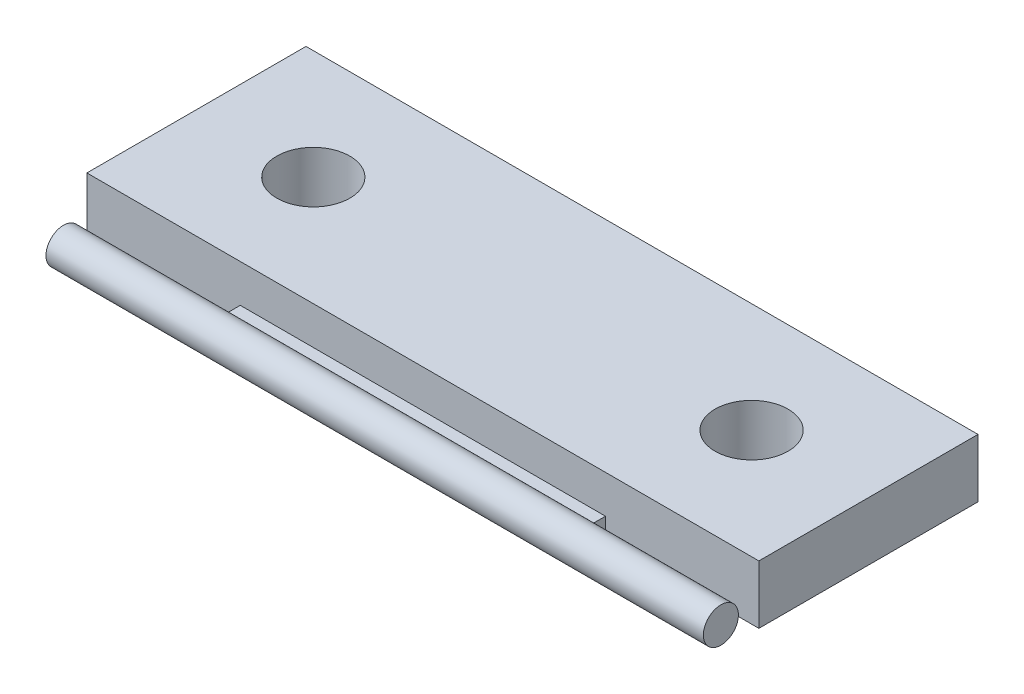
SolidWorks part; units mm, degrees
ref_plane "Front Plane" through (0, 0, 0) normal (0, 0, 1) x (1, 0, 0)
ref_plane "Top Plane" through (0, 0, 0) normal (0, 1, 0) x (1, 0, 0)
ref_plane "Right Plane" through (0, 0, 0) normal (1, 0, 0) x (0, 0, -1)
sketch "Sketch1" plane through (0, 0, 0) normal (0, 1, 0) x (1, 0, 0)
  line L1 (-25, 7.5) -> (25, 7.5)
  line L2 (-25, 7.5) -> (-25, -7.5)
  line L3 (-25, -7.5) -> (25, -7.5)
  line L4 (25, 7.5) -> (25, -7.5)
  line L5 (-25, 7.5) -> (25, -7.5) construction
  line L6 (-25, -7.5) -> (25, 7.5) construction
  point P0 (0, 0)
  dimension "D1" = 50
  dimension "D2" = 15
extrude "Boss-Extrude1" add sketch "Sketch1" along normal blind 2
sketch "Sketch2" plane through (25, 0, 0) normal (1, 0, 0) x (0, 0, -1)
  line L0 (-7.5, 2) -> (-7.5, 0) construction
  line L1 (-7.5, 1.4) -> (-7.5, 0.6)
  line L2 (-8.4686, 1.4) -> (-7.5, 1.4)
  line L3 (-8.4686, 0.6) -> (-7.5, 0.6)
  arc A1 (-8.4686, 1.4) -> (-8.4686, 0.6) centre (-9.6, 1) ccw
  dimension "D3" = 2.4
  dimension "D2" = 2.1
extrude "Boss-Extrude2" add sketch "Sketch2" against normal blind 25 from offset 12.5
sketch "Sketch3" plane through (12.5, 0, 0) normal (1, 0, 0) x (0, 0, -1)
  circle A0 centre (-9.6, 1) radius 1.2
extrude "Boss-Extrude3" add sketch "Sketch3" along normal blind 10 and the other way blind 35
sketch "Sketch5" plane through (0, 2, 0) normal (0, 1, 0) x (1, 0, 0)
  line L0 (-25, 7.5) -> (-25, -7.5) construction
  line L1 (25, -7.5) -> (25, 7.5) construction
  circle A0 centre (-15, 0) radius 2.5
  circle A1 centre (15, 0) radius 2.5
  dimension "D1" = 5
  dimension "D2" = 5
  dimension "D3" = 10
  dimension "D4" = 10
extrude "Cut-Extrude1" cut sketch "Sketch5" against normal blind 10
sketch "Sketch7" plane through (0, 2, 0) normal (0, 1, 0) x (1, 0, 0)
  line L4 (25, -7.5) -> (25, 7.5)
  line L5 (25, 7.5) -> (-25, 7.5)
  line L6 (-25, 7.5) -> (-25, -7.5)
  line L7 (-25, -7.5) -> (25, -7.5)
  line L8 (25, -7.5) -> (25, 7.5)
  line L9 (25, 7.5) -> (-25, 7.5)
  line L10 (-25, 7.5) -> (-25, -7.5)
  line L11 (-25, -7.5) -> (25, -7.5)
  circle A1 centre (15, 0) radius 2.5
  circle A2 centre (15, 0) radius 2.5
  circle A3 centre (-15, 0) radius 2.5
  circle A4 centre (-15, 0) radius 2.5
  dimension "D1" = 0
  dimension "D2" = 0
  dimension "D3" = 0
extrude "Boss-Extrude5" add sketch "Sketch7" along normal blind 2
sketch "Sketch8" plane through (0, 4, 0) normal (0, 1, 0) x (1, 0, 0)
  line L0 (-29.5253, 10.8151) -> (-23, 10.8151)
  line L1 (-23, 10.8151) -> (-23, -16.6248)
  line L2 (-23, -16.6248) -> (-29.5253, -16.6248)
  line L3 (-29.5253, -16.6248) -> (-29.5253, 10.8151)
  line L4 (23, 10.8151) -> (23, -16.6248)
  line L5 (23, -16.6248) -> (29.9436, -16.6248)
  line L6 (29.9436, -16.6248) -> (29.9436, 10.8151)
  line L7 (29.9436, 10.8151) -> (23, 10.8151)
  line L8 (-25, 7.5) -> (-25, -7.5) construction
  line L9 (25, -7.5) -> (25, 7.5) construction
  dimension "D1" = 2
  dimension "D2" = 2
extrude "Cut-Extrude2" cut sketch "Sketch8" against normal blind 10
